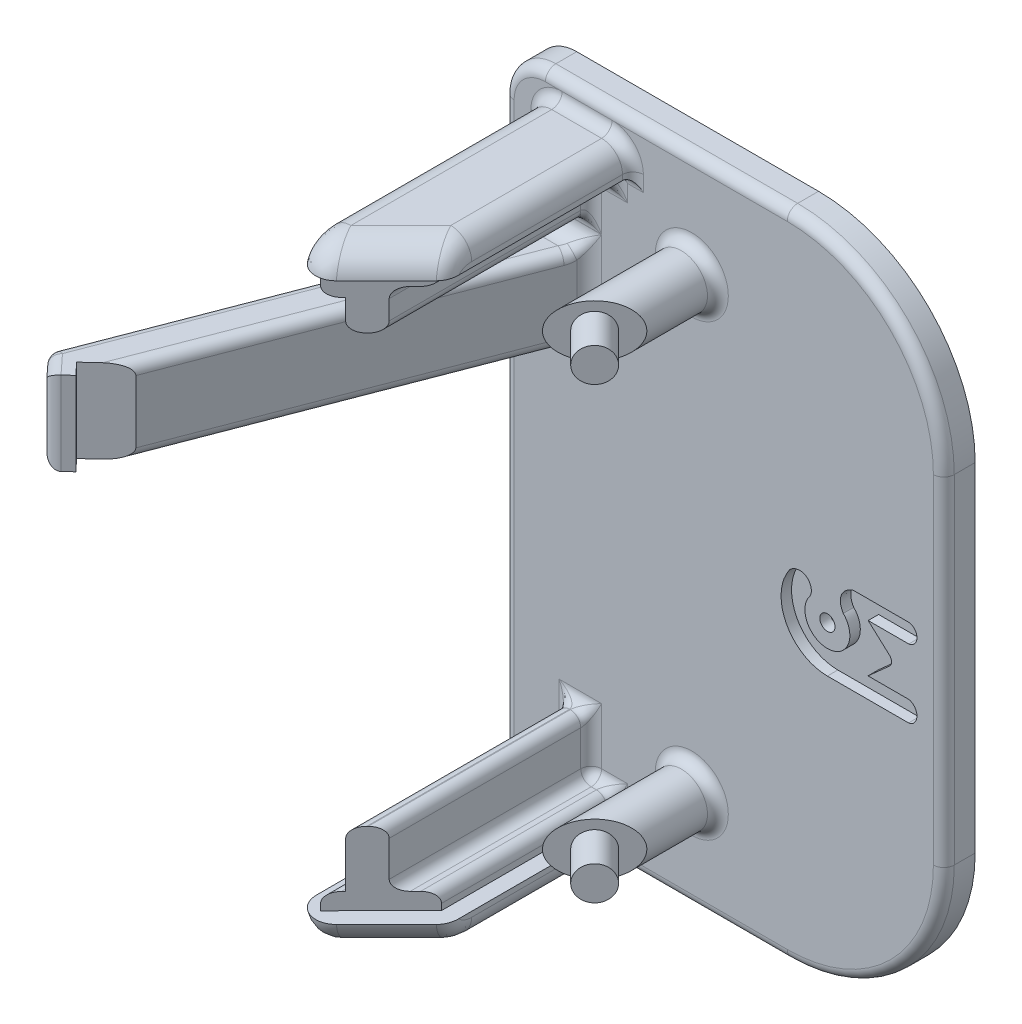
SolidWorks part; units mm, degrees
ref_plane "Front Plane" through (0, 0, 0) normal (0, 0, 1) x (1, 0, 0)
ref_plane "Top Plane" through (0, 0, 0) normal (0, 1, 0) x (1, 0, 0)
ref_plane "Right Plane" through (0, 0, 0) normal (1, 0, 0) x (0, 0, -1)
sketch "Sketch1" plane through (0, 0, 0) normal (0, 0, 1) x (1, 0, 0)
  circle A0 centre (49.5722, 9.7726) radius 2.5
  circle A1 centre (49.5722, 52.7726) radius 2.5
  dimension "D1" = 5
extrude "Boss-Extrude1" add sketch "Sketch1" along normal blind 12
sketch "Sketch2" plane through (0, 5.2784, 0) normal (0, -1, 0) x (1, 0, 0)
  line L1 (26.8033, 32.0723) -> (54.69, 32.0723)
  line L2 (26.8033, 32.0723) -> (52.2592, 6.6165)
  line L3 (26.8033, 32.0723) -> (52.2592, 6.6165)
  line L4 (54.69, 32.0723) -> (52.2592, 6.6165)
  dimension "D1" = 0.3
extrude "Cut-Extrude1" cut sketch "Sketch2" against normal through all
sketch "Sketch3" plane through (29.4378, 0, 29.4378) normal (0.7071, 0, 0.7071) x (0.7071, 0, -0.7071)
  circle A1 centre (28.4743, 9.7726) radius 1.625
  circle A2 centre (28.4743, 52.7726) radius 1.625
  dimension "D1" = 3.25
extrude "Boss-Extrude11" add sketch "Sketch3" along normal blind 4
sketch "Sketch4" plane through (0, 0, 0) normal (0, 0, 1) x (1, 0, 0)
  line L0 (52.4713, 5.2784) -> (52.4713, 57.2784) construction
  line L1 (52.4713, 31.2784) -> (11.8863, 31.2784) construction
  line L2 (34.7559, 5.2784) -> (28.1539, 5.2784) construction
  line L3 (28.1539, 5.2784) -> (27.0155, 5.2784) construction
  line L4 (32.7517, 5.2784) -> (28.1539, 5.2784)
  line L5 (28.1539, 5.2784) -> (27.0155, 5.2784)
  line L6 (32.7517, 6.2784) -> (28.1539, 6.2784)
  line L7 (28.1539, 6.2784) -> (27.442, 6.2784)
  line L8 (28.1539, 3.7784) -> (27.0155, 3.7784)
  line L9 (32.7517, 3.7784) -> (28.1539, 3.7784)
  line L10 (23.4633, 7.3919) -> (26.0211, 7.3919)
  line L11 (24.9889, 7.3919) -> (27.0155, 5.2784) construction
  line L12 (25.7107, 8.084) -> (27.442, 6.2784) construction
  line L14 (32.7517, 6.2784) -> (32.7517, 3.7784)
  line L15 (34.7559, 6.2784) -> (28.1539, 6.2784) construction
  line L16 (34.7559, 3.7784) -> (28.1539, 3.7784) construction
  line L17 (34.7559, 5.2784) -> (28.1539, 5.2784) construction
  ellipse E2 centre (27.0155, 8.2784) end of major axis (27.0155, 5.2784) minor radius 2.1213 (24.8941, 8.2784) -> (27.0155, 5.2784) ccw construction
  ellipse E3 centre (27.0155, 8.2784) end of major axis (27.0155, 5.2784) minor radius 2.1213 (24.9889, 7.3919) -> (27.0155, 5.2784) ccw
  spline S0 degree 2 poles (27.442, 6.2784) (26.2905, 6.2328) (26.0211, 7.3919) knots 0 0 0 1 1 1
  spline S2 degree 1 poles (23.5235, 7.0714) (27.0155, 3.7784) knots 0 0 1 1 construction
  spline S3 degree 3 poles (23.5235, 7.0714) (23.6144, 6.656) (23.8952, 5.8401) (24.6195, 4.7813) (25.6693, 3.989) (26.573, 3.7784) (27.0155, 3.7784) knots -1.270803 -1.270803 -1.270803 -1.270803 -0.953103 -0.635402 -0.317701 0 0 0 0 only from (23.4633, 7.3919) to (27.0155, 3.7784)
  dimension "D1" = 1
  dimension "D2" = 1.5
sketch "Sketch11" plane through (0, 0, 0) normal (0, 0, 1) x (1, 0, 0)
  line L0 (36.6555, 4.8807) -> (42.4348, 4.8807)
  line L1 (37.8555, 6.4807) -> (37.8555, 11.8807)
  line L2 (39.9348, 6.4807) -> (39.9348, 11.8807)
  line L3 (52.4713, 31.2784) -> (11.8863, 31.2784) construction
  line L4 (39.9348, 11.8807) -> (37.8555, 11.8807)
  line L5 (39.9348, 11.8807) -> (39.9348, 60.1878) construction
  line L6 (36.6555, 6.4807) -> (36.6555, 60.9475) construction
  line L7 (37.8555, 6.4807) -> (36.6555, 6.4807)
  line L8 (36.6555, 4.8807) -> (36.6555, 6.4807)
  line L9 (37.8555, 11.8807) -> (37.8555, 60.1878) construction
  line L10 (42.4348, 6.4807) -> (42.4348, 61.454) construction
  line L11 (39.9348, 6.4807) -> (42.4348, 6.4807)
  line L12 (42.4348, 4.8807) -> (42.4348, 6.4807)
  line L13 (36.6555, 58.2559) -> (42.4348, 58.2559)
  line L14 (42.4348, 58.2559) -> (42.4348, 56.6559)
  line L15 (42.4348, 56.6559) -> (39.9348, 56.6559)
  line L16 (39.9348, 56.6559) -> (39.9348, 52.8014)
  line L17 (39.9348, 52.8014) -> (37.8555, 52.8014)
  line L18 (37.8555, 52.8014) -> (37.8555, 55.7559)
  line L19 (37.8555, 55.7559) -> (36.6555, 55.7559)
  line L20 (36.6555, 55.7559) -> (36.6555, 58.2559)
  dimension "D1" = 1.6
  dimension "D2" = 2.5
  dimension "D3" = 1.6
  dimension "D4" = 1.6
  dimension "D5" = 1.2
extrude "Boss-Extrude9" add sketch "Sketch11" along normal blind 23
sketch "Sketch12" plane through (0, 5.2784, 0) normal (0, -1, 0) x (1, 0, 0)
  line L0 (43.1151, 16.1445) -> (35.3217, 23.9883)
  line L1 (35.3217, 23.9883) -> (38.352, 26.0464)
  line L2 (38.352, 26.0464) -> (51.5805, 20.4517)
  line L3 (51.5805, 20.4517) -> (43.1151, 16.1445)
extrude "Cut-Extrude6" cut sketch "Sketch12" against normal up to surface and the other way up to surface
sketch "Sketch13" plane through (0, 0, 0) normal (0, 0, 1) x (1, 0, 0)
  line L0 (42.4348, 6.4807) -> (42.4348, 4.8807) construction
  line L1 (35.1555, 2.3807) -> (35.1555, 4.8807)
  line L2 (43.9348, 4.8807) -> (43.9348, 2.3807)
  line L3 (43.9348, 2.3807) -> (35.1555, 2.3807)
  line L4 (35.1555, 4.8807) -> (43.9348, 4.8807)
  line L6 (52.4713, 31.2784) -> (11.8863, 31.2784) construction
  line L7 (52.4713, 5.2784) -> (52.4713, 57.2784) construction
  line L8 (43.9348, 58.2717) -> (43.9348, 60.7717)
  line L9 (43.9348, 60.7717) -> (35.1555, 60.7717)
  line L10 (43.9348, 58.2717) -> (35.1555, 58.2717)
  line L11 (35.1555, 58.2717) -> (35.1555, 60.7717)
  dimension "D1" = 2.5
  dimension "D2" = 2.5
  dimension "D3" = 1.5
extrude "Boss-Extrude10" add sketch "Sketch13" along normal blind 27
sketch "Sketch14" plane through (0, 5.2784, 0) normal (0, 1, 0) x (1, 0, 0)
  line L0 (45.0913, -16.4713) -> (34.4268, -27.15)
  line L1 (34.4268, -27.15) -> (42.7839, -30.8366)
  line L2 (42.7839, -30.8366) -> (51.6362, -30.1219)
  line L3 (51.6362, -30.1219) -> (53.9172, -23.7765)
  line L4 (53.9172, -23.7765) -> (45.0913, -16.4713)
extrude "Cut-Extrude7" cut sketch "Sketch14" against normal blind 26 and the other way through all
fillet "Fillet1" radius 3 1 edges at (39.5452, 2.3807, 22.0248)
fillet "Fillet2" radius 2 4 edges at (43.9348, 3.0894, 16.1837) (35.1555, 2.3807, 11.1171) (43.9348, 2.3807, 6.7216) (35.1555, 3.0894, 24.9746)
ref_plane "Plane1" through (0, 31.2784, 0) normal (0, 1, 0) x (0, 0, 1)
fillet "Fillet3" radius 3 1 edges at (39.5452, 60.7717, 22.0248)
fillet "Fillet4" radius 2 4 edges at (35.1555, 60.063, 24.9746) (43.9348, 60.063, 16.1837) (35.1555, 60.7717, 11.1171) (43.9348, 60.7717, 6.7216)
sketch "Sketch15" plane through (0, 0, 0) normal (0, 0, 1) x (1, 0, 0)
  line L0 (37.1555, 60.7717) -> (41.9348, 60.7717) construction
  line L1 (31.5543, 62.7717) -> (73.7149, 62.7717)
  line L2 (31.5543, 62.7717) -> (31.5543, 0.3807)
  line L3 (31.5543, 0.3807) -> (73.7149, 0.3807)
  line L4 (73.7149, 62.7717) -> (73.7149, 0.3807)
  line L5 (41.9348, 2.3807) -> (37.1555, 2.3807) construction
  dimension "D1" = 2
  dimension "D2" = 2
extrude "Boss-Extrude12" add sketch "Sketch15" against normal blind 3
fillet "Fillet5" radius 1 34 edges at (43.9348, 58.5217, 0) (43.3491, 60.1859, 0) (39.5452, 60.7717, 0) (35.7413, 60.1859, 0) (35.1555, 58.5217, 0) (39.5452, 58.2717, 0) (37.8555, 54.2787, 0) (38.8952, 52.8014, 0) (39.9348, 54.7287, 0) (41.1848, 56.6559, 0) (42.4348, 57.4559, 0) (39.5452, 58.2559, 0) (36.6555, 57.0059, 0) (37.2555, 55.7559, 0) (41.1848, 6.4807, 0) (39.9348, 9.1807, 0) (38.8952, 11.8807, 0) (37.8555, 9.1807, 0) (37.2555, 6.4807, 0) (35.1555, 4.6307, 0) (35.7413, 2.9664, 0) (39.5452, 2.3807, 0) (43.3491, 2.9664, 0) (43.9348, 4.6307, 0) (52.6346, 62.7717, 0) (73.7149, 31.5762, 0) (52.6346, 0.3807, 0) (31.5543, 31.5762, 0) (52.0722, 9.7726, 0) (52.0722, 52.7726, 0)
sketch "Sketch16" plane through (0, 0, 0) normal (0, 0, 1) x (1, 0, 0)
  line L0 (312.859, 85.3333) -> (312.859, 426.6667) construction
  line L1 (62.5608, 29.675) -> (62.5608, 31.1627) construction
  line L2 (61.7928, 30.4188) -> (63.2926, 30.4188) construction
  line L3 (62.5608, 25.9828) -> (70.3387, 25.9828)
  line L4 (66.4498, 27.9433) -> (70.3568, 27.9433)
  line L5 (66.4498, 27.9433) -> (68.5103, 29.7833)
  line L6 (65.0779, 34.3387) -> (70.3568, 34.3387)
  line L7 (70.3568, 27.9433) -> (70.3568, 32.5408) construction
  line L8 (66.4643, 32.5408) -> (70.3568, 32.5408)
  line L9 (70.3568, 30.2421) -> (71.0775, 30.2421) construction
  line L10 (68.4297, 30.7607) -> (66.4643, 32.5408)
  circle A0 centre (62.5608, 30.4188) radius 0.7318
  arc A1 (60.8747, 31.758) -> (64.0861, 31.9387) centre (62.5608, 30.4188) ccw
  arc A2 (58.9245, 32.9596) -> (62.5608, 25.9828) centre (62.5608, 30.4188) ccw
  spline S0 degree 3 poles (60.812, 31.675) (61.2115, 32.1405) (60.8075, 33.725) (59.2728, 33.419) (58.9245, 32.9596) knots 0 0 0 0 0.502783 1 1 1 1
  spline S1 degree 3 poles (70.3387, 25.9828) (70.8165, 26.026) (71.462, 26.9742) (70.8039, 27.8735) (70.3568, 27.9433) knots 0 0 0 0 0.510068 1 1 1 1
  spline S2 degree 2 poles (68.5103, 29.7833) (68.9741, 30.2552) (68.4297, 30.7607) knots 0 0 0 1 1 1
  spline S3 degree 3 poles (64.0861, 31.9387) (63.8582, 32.2965) (63.5699, 33.4196) (64.531, 34.2166) (65.0779, 34.3387) knots 0 0 0 0 0.42958 1 1 1 1
  spline S4 degree 3 poles (70.3568, 32.5408) (70.6394, 32.565) (71.041, 32.8626) (71.188, 33.5143) (70.9761, 34.1013) (70.5887, 34.3348) (70.3568, 34.3387) knots 0 0 0 0 0.321053 0.517682 0.738255 1 1 1 1
extrude "Cut-Extrude8" cut sketch "Sketch16" against normal blind 1 contours L8 S4 L6 S3 A1 S0 A2 L3 S1 L4 L5 S2 L10 | A0
fillet "Fillet6" radius 15 4 edges at (73.422, 0.6735, -0.2929) (73.422, 62.4788, -0.2929) (73.7149, 62.7717, -2) (73.7149, 0.3807, -2)
fillet "Fillet7" radius 4 4 edges at (31.8472, 62.4788, -0.2929) (31.8472, 0.6735, -0.2929) (31.5543, 0.3807, -2) (31.5543, 62.7717, -2)
fillet "Fillet8" radius 1 10 edges at (36.3626, 6.7735, 0.2929) (37.5626, 12.1735, 0.2929) (40.2277, 12.1735, 0.2929) (40.2277, 6.7735, 0.2929) (42.7277, 6.7735, 0.2929) (36.6555, 6.4807, 11.8229) (37.8555, 11.8807, 11.219) (39.9348, 11.8807, 10.1727) (39.9348, 6.4807, 10.1727) (42.4348, 6.4807, 8.9146)
fillet "Fillet9" radius 1 10 edges at (42.7277, 56.363, 0.2929) (40.2277, 56.363, 0.2929) (40.2277, 52.5085, 0.2929) (37.5626, 52.5085, 0.2929) (36.3626, 55.463, 0.2929) (42.4348, 56.6559, 8.9146) (39.9348, 56.6559, 10.1727) (39.9348, 52.8014, 10.1727) (37.8555, 52.8014, 11.219) (36.6555, 55.7559, 11.8229)
ref_plane "Plane2" through (0, 42.2784, 0) normal (0, 1, 0) x (0, 0, 1)
sketch "Sketch17" plane through (0, 42.2784, 0) normal (0, 1, 0) x (0, 0, 1)
  line L0 (31.4893, 27.8106) -> (0, 39.8999)
  line L1 (0, 36.8555) -> (0, 40.9348) construction
  line L3 (35.3521, 25.9175) -> (36.7081, 24.4474)
  line L4 (36.7081, 24.4474) -> (34.401, 22.3196)
  line L5 (0, 39.8999) -> (0, 35.5268)
  line L6 (0, 35.5268) -> (34.401, 22.3196)
  line L7 (31.4893, 27.8106) -> (34.2083, 24.8626)
  line L8 (34.2083, 24.8626) -> (35.3521, 25.9175)
  dimension "D2" = 2
extrude "Boss-Extrude13" add sketch "Sketch17" along normal blind 8
fillet "Fillet10" radius 5 1 edges at (35.5268, 46.2784, 0)
fillet "Fillet12" radius 1.5 5 edges at (32.2195, 42.2784, -0.0577) (32.2195, 50.2784, -0.0577) (39.8999, 46.2784, 0) (36.2271, 42.2784, 0) (36.2271, 50.2784, 0)
fillet "Fillet14" radius 1 16 edges at (40.0812, 50.9288, 0.2638) (39.429, 50.3035, 1.2266) (40.0812, 41.628, 0.2638) (39.429, 42.2533, 1.2266) (33.6998, 51.8298, 2.8316) (33.7641, 50.2784, 3.4572) (24.4474, 46.2784, 36.7081) (23.3835, 50.2784, 35.5545) (23.3835, 42.2784, 35.5545) (33.5673, 50.2784, 16.4947) (33.5673, 42.2784, 16.4947) (27.8777, 50.2784, 19.9237) (22.3196, 46.2784, 34.401) (33.7641, 42.2784, 3.4572) (27.8777, 42.2784, 19.9237)
